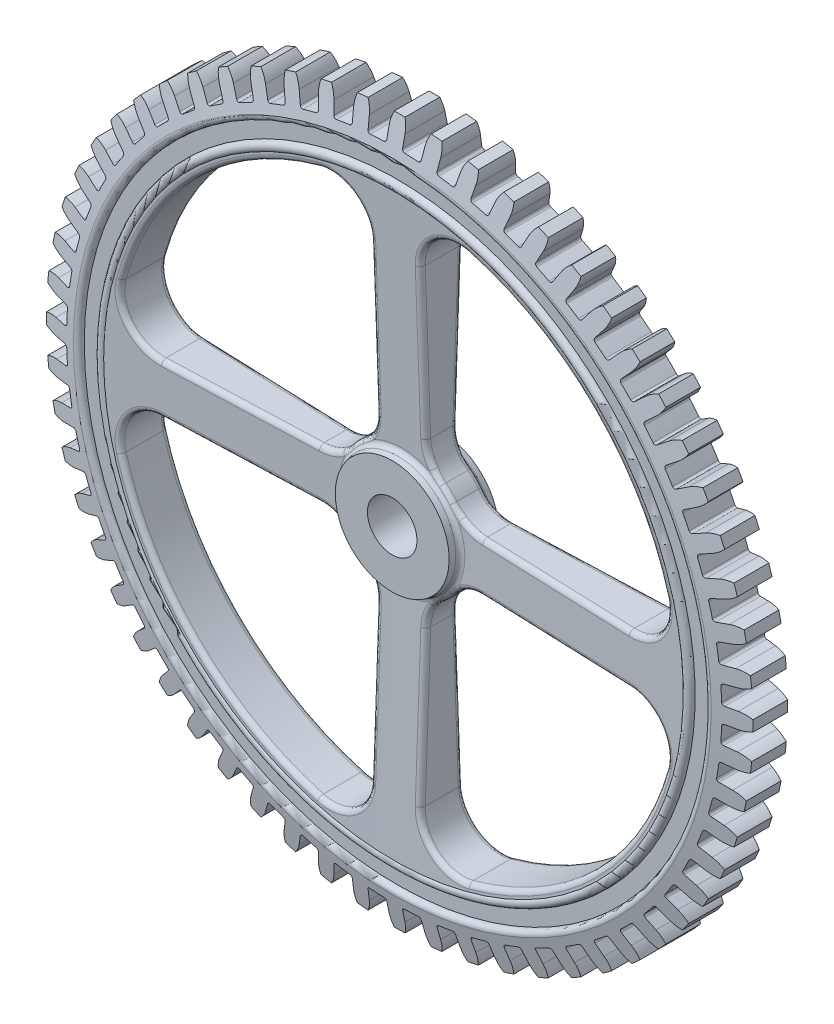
SolidWorks part; units mm, degrees
ref_plane "Спереди" through (0, 0, 0) normal (0, 0, 1) x (1, 0, 0)
ref_plane "Сверху" through (0, 0, 0) normal (0, 1, 0) x (1, 0, 0)
ref_plane "Справа" through (0, 0, 0) normal (1, 0, 0) x (0, 0, -1)
sketch "Эскиз1" plane through (0, 0, 0) normal (0, 1, 0) x (1, 0, 0)
  line L0 (-71.3, 0) -> (0, 0) construction
  line L1 (-71.3, -3.5) -> (-71.3, 3.5)
  line L2 (-5, 5) -> (-5, -5)
  line L3 (-5, 5) -> (-11.485, 5)
  line L4 (-71.3, 3.5) -> (-64.3459, 4.9781)
  line L5 (-63.138, 4) -> (-60.138, 4)
  line L6 (-11.485, 5) -> (-11.7073, 3.8775)
  line L7 (-12.7249, 3.0724) -> (-58.4765, 4.75)
  line L8 (-5, -5) -> (-11.485, -5)
  line L9 (-11.485, -5) -> (-11.7073, -3.8775)
  line L10 (-12.7249, -3.0724) -> (-58.4765, -4.75)
  line L11 (-63.138, -4) -> (-60.138, -4)
  line L12 (-71.3, -3.5) -> (-64.3459, -4.9781)
  line L13 (0, 5) -> (0, -5) construction
  arc A0 (-63.138, 4) -> (-64.3459, 4.9781) centre (-64.138, 4) ccw
  arc A1 (-58.4765, 4.75) -> (-60.138, 4) centre (-59.138, 4) ccw
  arc A2 (-11.7073, 3.8775) -> (-12.7249, 3.0724) centre (-12.6882, 4.0717) cw
  arc A3 (-11.7073, -3.8775) -> (-12.7249, -3.0724) centre (-12.6882, -4.0717) ccw
  arc A4 (-58.4765, -4.75) -> (-60.138, -4) centre (-59.138, -4) cw
  arc A5 (-63.138, -4) -> (-64.3459, -4.9781) centre (-64.138, -4) cw
  point P17 (-5, 0)
  dimension "D7" = 2
  dimension "D13" = 1
  dimension "D1" = 71.3
  dimension "D2" = 5
  dimension "D3" = 5
  dimension "D4" = 6.485
  dimension "D5" = 3.5
  dimension "D6" = 12
  dimension "D8" = 3
  dimension "D9" = 4
  dimension "D10" = 11.2
  dimension "D11" = 2.1
  dimension "D12" = 0.25
revolve "Повернуть1" add sketch "Эскиз1" angle 360 about L13
sketch "Эскиз2" plane through (0, 0, 0) normal (0, 0, 1) x (1, 0, 0)
  line L0 (0, 87.2902) -> (0, 0) construction
  line L1 (0, 0) -> (53, 0) construction
  line L2 (5, 47.244) -> (5, 16.4924)
  line L3 (16.4924, 5) -> (47.244, 5)
  line L4 (47.244, -5) -> (16.4924, -5)
  line L5 (5, -16.4924) -> (5, -47.244)
  line L6 (-5, -47.244) -> (-5, -16.4924)
  line L7 (-16.4924, -5) -> (-47.244, -5)
  line L8 (-47.244, 5) -> (-16.4924, 5)
  line L9 (-5, 16.4924) -> (-5, 47.244)
  arc A0 (10.2096, 8.0476) -> (8.0476, 10.2096) centre (0, 0) ccw
  arc A1 (54.9574, 15.1224) -> (15.1224, 54.9574) centre (0, 0) ccw
  arc A2 (47.244, 5) -> (54.9574, 15.1224) centre (47.244, 13) ccw
  arc A3 (16.4924, 5) -> (10.2096, 8.0476) centre (16.4924, 13) cw
  arc A4 (5, 16.4924) -> (8.0476, 10.2096) centre (13, 16.4924) ccw
  arc A5 (5, 47.244) -> (15.1224, 54.9574) centre (13, 47.244) cw
  arc A6 (8.0476, -10.2096) -> (10.2096, -8.0476) centre (0, 0) ccw
  arc A7 (15.1224, -54.9574) -> (54.9574, -15.1224) centre (0, 0) ccw
  arc A8 (5, -47.244) -> (15.1224, -54.9574) centre (13, -47.244) ccw
  arc A9 (5, -16.4924) -> (8.0476, -10.2096) centre (13, -16.4924) cw
  arc A10 (16.4924, -5) -> (10.2096, -8.0476) centre (16.4924, -13) ccw
  arc A11 (47.244, -5) -> (54.9574, -15.1224) centre (47.244, -13) cw
  arc A12 (-10.2096, -8.0476) -> (-8.0476, -10.2096) centre (0, 0) ccw
  arc A13 (-54.9574, -15.1224) -> (-15.1224, -54.9574) centre (0, 0) ccw
  arc A14 (-47.244, -5) -> (-54.9574, -15.1224) centre (-47.244, -13) ccw
  arc A15 (-16.4924, -5) -> (-10.2096, -8.0476) centre (-16.4924, -13) cw
  arc A16 (-5, -16.4924) -> (-8.0476, -10.2096) centre (-13, -16.4924) ccw
  arc A17 (-5, -47.244) -> (-15.1224, -54.9574) centre (-13, -47.244) cw
  arc A18 (-8.0476, 10.2096) -> (-10.2096, 8.0476) centre (0, 0) ccw
  arc A19 (-15.1224, 54.9574) -> (-54.9574, 15.1224) centre (0, 0) ccw
  arc A20 (-5, 47.244) -> (-15.1224, 54.9574) centre (-13, 47.244) ccw
  arc A21 (-5, 16.4924) -> (-8.0476, 10.2096) centre (-13, 16.4924) cw
  arc A22 (-16.4924, 5) -> (-10.2096, 8.0476) centre (-16.4924, 13) ccw
  arc A23 (-47.244, 5) -> (-54.9574, 15.1224) centre (-47.244, 13) cw
  dimension "D3" = 26
  dimension "D4" = 114
  dimension "D5" = 8
  dimension "D1" = 5
  dimension "D2" = 5
  dimension "D7" = 10
  dimension "D9" = 53
  dimension "D6" = 4
extrude "Вырез-Вытянуть1" cut sketch "Эскиз2" against normal mid plane 10
fillet "Скругление1" radius 1 64 edges at (-12.1999, 6.2492, -3.1084) (-9.1924, 9.1924, -3.0825) (-5.4509, 13.8447, -3.1514) (-7.5875, 53.1351, -4.5739) (-40.3051, 40.3051, -4.6959) (-6.2492, -12.1999, -3.1084) (-9.1924, -9.1924, -3.0825) (-13.8447, -5.4509, -3.1514) (-53.1351, -7.5875, -4.5739) (-40.3051, -40.3051, -4.6959) (-8.7638, -54.0304, -4.6129) (12.1999, -6.2492, -3.1084) (9.1924, -9.1924, -3.0825) (5.4509, -13.8447, -3.1514) (7.5875, -53.1351, -4.5739) (40.3051, -40.3051, -4.6959) (54.0304, -8.7638, -4.6129) (53.1351, 7.5875, -4.5739) (40.3051, 40.3051, -4.6959) (8.7638, 54.0304, -4.6129) (6.2492, 12.1999, -3.1084) (9.1924, 9.1924, -3.0825) (13.8447, 5.4509, -3.1514) (12.1999, 6.2492, 3.1084) (9.1924, 9.1924, 3.0825) (5.4509, 13.8447, 3.1514) (7.5875, 53.1351, 4.5739) (40.3051, 40.3051, 4.6959) (54.0304, 8.7638, 4.6129) (53.1351, -7.5875, 4.5739) (40.3051, -40.3051, 4.6959) (8.7638, -54.0304, 4.6129) (6.2492, -12.1999, 3.1084) (9.1924, -9.1924, 3.0825) (13.8447, -5.4509, 3.1514) (-12.1999, -6.2492, 3.1084) (-9.1924, -9.1924, 3.0825) (-5.4509, -13.8447, 3.1514) (-7.5875, -53.1351, 4.5739) (-40.3051, -40.3051, 4.6959) (-54.0304, -8.7638, 4.6129) (-40.3051, 40.3051, 4.6959) (-8.7638, 54.0304, 4.6129) (-6.2492, 12.1999, 3.1084) (-9.1924, 9.1924, 3.0825) (-13.8447, 5.4509, 3.1514) (-54.0304, 8.7638, -4.6129) (-53.1351, 7.5875, 4.5739)
sketch "Эскиз5" plane through (0, 0, 0) normal (0, 0, 1) x (1, 0, 0)
  line L0 (0, 80.2004) -> (0, -81.6903) construction
  line L1 (0, 0) -> (3.6112, 68.9054) construction
  line L2 (-1.6, 68.8596) -> (-1.6, 66.5669)
  line L3 (1.6, 68.8596) -> (1.6, 66.5669)
  line L4 (5.6065, 68.6496) -> (5.3669, 66.3695)
  line L5 (8.789, 68.3151) -> (8.5494, 66.035)
  line L6 (12.7517, 67.6875) -> (12.275, 65.4449)
  line L7 (15.8817, 67.0222) -> (15.4051, 64.7796)
  line L8 (19.7571, 65.9838) -> (19.0486, 63.8033)
  line L9 (22.8005, 64.9949) -> (22.092, 62.8144)
  line L10 (26.546, 63.5571) -> (25.6135, 61.4627)
  line L11 (29.4694, 62.2556) -> (28.5369, 60.1611)
  line L12 (33.0441, 60.4341) -> (31.8978, 58.4486)
  line L13 (35.8154, 58.8341) -> (34.6691, 56.8486)
  line L14 (39.1802, 56.649) -> (37.8326, 54.7942)
  line L15 (41.7691, 54.7681) -> (40.4215, 52.9133)
  line L16 (44.887, 52.2432) -> (43.3529, 50.5394)
  line L17 (47.2651, 50.102) -> (45.731, 48.3982)
  line L18 (50.102, 47.2651) -> (48.3982, 45.731)
  line L19 (52.2432, 44.887) -> (50.5394, 43.3529)
  line L20 (54.7681, 41.7691) -> (52.9133, 40.4215)
  line L21 (56.649, 39.1802) -> (54.7942, 37.8326)
  line L22 (58.8341, 35.8154) -> (56.8486, 34.6691)
  line L23 (60.4341, 33.0441) -> (58.4486, 31.8978)
  line L24 (62.2556, 29.4694) -> (60.1611, 28.5369)
  line L25 (63.5571, 26.546) -> (61.4627, 25.6135)
  line L26 (64.9949, 22.8005) -> (62.8144, 22.092)
  line L27 (65.9838, 19.7571) -> (63.8033, 19.0486)
  line L28 (67.0222, 15.8817) -> (64.7796, 15.4051)
  line L29 (67.6875, 12.7517) -> (65.4449, 12.275)
  line L30 (68.3151, 8.789) -> (66.035, 8.5494)
  line L31 (68.6496, 5.6065) -> (66.3695, 5.3669)
  line L32 (68.8596, 1.6) -> (66.5669, 1.6)
  line L33 (68.8596, -1.6) -> (66.5669, -1.6)
  line L34 (68.6496, -5.6065) -> (66.3695, -5.3669)
  line L35 (68.3151, -8.789) -> (66.035, -8.5494)
  line L36 (67.6875, -12.7517) -> (65.4449, -12.275)
  line L37 (67.0222, -15.8817) -> (64.7796, -15.4051)
  line L38 (65.9838, -19.7571) -> (63.8033, -19.0486)
  line L39 (64.9949, -22.8005) -> (62.8144, -22.092)
  line L40 (63.5571, -26.546) -> (61.4627, -25.6135)
  line L41 (62.2556, -29.4694) -> (60.1611, -28.5369)
  line L42 (60.4341, -33.0441) -> (58.4486, -31.8978)
  line L43 (58.8341, -35.8154) -> (56.8486, -34.6691)
  line L44 (56.649, -39.1802) -> (54.7942, -37.8326)
  line L45 (54.7681, -41.7691) -> (52.9133, -40.4215)
  line L46 (52.2432, -44.887) -> (50.5394, -43.3529)
  line L47 (50.102, -47.2651) -> (48.3982, -45.731)
  line L48 (47.2651, -50.102) -> (45.731, -48.3982)
  line L49 (44.887, -52.2432) -> (43.3529, -50.5394)
  line L50 (41.7691, -54.7681) -> (40.4215, -52.9133)
  line L51 (39.1802, -56.649) -> (37.8326, -54.7942)
  line L52 (35.8154, -58.8341) -> (34.6691, -56.8486)
  line L53 (33.0441, -60.4341) -> (31.8978, -58.4486)
  line L54 (29.4694, -62.2556) -> (28.3391, -59.7169)
  line L55 (26.546, -63.5571) -> (25.6135, -61.4627)
  line L56 (22.8005, -64.9949) -> (22.092, -62.8144)
  line L57 (19.7571, -65.9838) -> (19.0486, -63.8033)
  line L58 (15.8817, -67.0222) -> (15.4051, -64.7796)
  line L59 (12.7517, -67.6875) -> (12.275, -65.4449)
  line L60 (8.789, -68.3151) -> (8.5494, -66.035)
  line L61 (5.6065, -68.6496) -> (5.3669, -66.3695)
  line L62 (1.6, -68.8596) -> (1.6, -66.5669)
  line L63 (-1.6, -68.8596) -> (-1.6, -66.5669)
  line L64 (-5.6065, -68.6496) -> (-5.3161, -65.8859)
  line L65 (-8.789, -68.3151) -> (-8.5494, -66.035)
  line L66 (-12.7517, -67.6875) -> (-12.275, -65.4449)
  line L67 (-15.8817, -67.0222) -> (-15.4051, -64.7796)
  line L68 (-19.7571, -65.9838) -> (-19.0486, -63.8033)
  line L69 (-22.8005, -64.9949) -> (-22.092, -62.8144)
  line L70 (-26.546, -63.5571) -> (-25.6135, -61.4627)
  line L71 (-29.4694, -62.2556) -> (-28.5369, -60.1611)
  line L72 (-33.0441, -60.4341) -> (-31.8978, -58.4486)
  line L73 (-35.8154, -58.8341) -> (-34.6691, -56.8486)
  line L74 (-39.1802, -56.649) -> (-37.8326, -54.7942)
  line L75 (-41.7691, -54.7681) -> (-40.4215, -52.9133)
  line L76 (-44.887, -52.2432) -> (-43.3529, -50.5394)
  line L77 (-47.2651, -50.102) -> (-45.731, -48.3982)
  line L78 (-50.102, -47.2651) -> (-48.3982, -45.731)
  line L79 (-52.2432, -44.887) -> (-50.5394, -43.3529)
  line L80 (-54.7681, -41.7691) -> (-52.9133, -40.4215)
  line L81 (-56.649, -39.1802) -> (-54.7942, -37.8326)
  line L82 (-58.8341, -35.8154) -> (-56.8486, -34.6691)
  line L83 (-60.4341, -33.0441) -> (-58.4486, -31.8978)
  line L84 (-62.2556, -29.4694) -> (-60.1611, -28.5369)
  line L85 (-63.5571, -26.546) -> (-61.4627, -25.6135)
  line L86 (-64.9949, -22.8005) -> (-62.8144, -22.092)
  line L87 (-65.9838, -19.7571) -> (-63.8033, -19.0486)
  line L88 (-67.0222, -15.8817) -> (-64.7796, -15.4051)
  line L89 (-67.6875, -12.7517) -> (-65.4449, -12.275)
  line L90 (-68.3151, -8.789) -> (-66.035, -8.5494)
  line L91 (-68.6496, -5.6065) -> (-66.3695, -5.3669)
  line L92 (-68.8596, -1.6) -> (-66.5669, -1.6)
  line L93 (-68.8596, 1.6) -> (-66.5669, 1.6)
  line L94 (-68.6496, 5.6065) -> (-66.3695, 5.3669)
  line L95 (-68.3151, 8.789) -> (-66.035, 8.5494)
  line L96 (-67.6875, 12.7517) -> (-65.4449, 12.275)
  line L97 (-67.0222, 15.8817) -> (-64.7796, 15.4051)
  line L98 (-65.9838, 19.7571) -> (-63.8033, 19.0486)
  line L99 (-64.9949, 22.8005) -> (-62.8144, 22.092)
  line L100 (-63.5571, 26.546) -> (-61.4627, 25.6135)
  line L101 (-62.2556, 29.4694) -> (-60.1611, 28.5369)
  line L102 (-60.4341, 33.0441) -> (-58.4486, 31.8978)
  line L103 (-58.8341, 35.8154) -> (-56.8486, 34.6691)
  line L104 (-56.649, 39.1802) -> (-54.7942, 37.8326)
  line L105 (-54.7681, 41.7691) -> (-52.9133, 40.4215)
  line L106 (-52.2432, 44.887) -> (-50.5394, 43.3529)
  line L107 (-50.102, 47.2651) -> (-48.3982, 45.731)
  line L108 (-47.2651, 50.102) -> (-45.731, 48.3982)
  line L109 (-44.887, 52.2432) -> (-43.3529, 50.5394)
  line L110 (-41.7691, 54.7681) -> (-40.4215, 52.9133)
  line L111 (-39.1802, 56.649) -> (-37.8326, 54.7942)
  line L112 (-35.8154, 58.8341) -> (-34.6691, 56.8486)
  line L113 (-33.0441, 60.4341) -> (-31.8978, 58.4486)
  line L114 (-29.4694, 62.2556) -> (-28.5369, 60.1611)
  line L115 (-26.546, 63.5571) -> (-25.6135, 61.4627)
  line L116 (-22.8005, 64.9949) -> (-22.092, 62.8144)
  line L117 (-19.7571, 65.9838) -> (-19.0486, 63.8033)
  line L118 (-15.8817, 67.0222) -> (-15.4051, 64.7796)
  line L119 (-12.7517, 67.6875) -> (-12.275, 65.4449)
  line L120 (-8.789, 68.3151) -> (-8.5494, 66.035)
  line L121 (-5.6065, 68.6496) -> (-5.3669, 66.3695)
  arc A0 (-2.0842, 66.0671) -> (-4.8331, 65.9231) centre (0, 0) ccw
  circle A1 centre (0, 0) radius 71.3 construction
  arc A2 (-1.0849, 71.2917) -> (-1.6, 68.8596) centre (4.4, 68.8596) ccw
  circle A3 centre (0, 0) radius 69 construction
  arc A4 (1.0849, 71.2917) -> (1.6, 68.8596) centre (-4.4, 68.8596) cw
  arc A5 (1.0849, 71.2917) -> (-1.0849, 71.2917) centre (0, 0) ccw
  arc A6 (6.373, 71.0146) -> (5.6065, 68.6496) centre (11.5737, 68.0224) ccw
  arc A7 (8.531, 70.7878) -> (8.789, 68.3151) centre (2.8219, 68.9423) cw
  arc A8 (8.531, 70.7878) -> (6.373, 71.0146) centre (0, 0) ccw
  arc A9 (13.7612, 69.9594) -> (12.7517, 67.6875) centre (18.6206, 66.44) ccw
  arc A10 (15.8836, 69.5083) -> (15.8817, 67.0222) centre (10.0129, 68.2696) cw
  arc A11 (15.8836, 69.5083) -> (13.7612, 69.9594) centre (0, 0) ccw
  arc A12 (20.9985, 68.1377) -> (19.7571, 65.9838) centre (25.4634, 64.1297) ccw
  arc A13 (23.0622, 67.4672) -> (22.8005, 64.9949) centre (17.0941, 66.849) cw
  arc A14 (23.0622, 67.4672) -> (20.9985, 68.1377) centre (0, 0) ccw
  arc A15 (28.0058, 65.5695) -> (26.546, 63.5571) centre (32.0273, 61.1167) ccw
  arc A16 (29.9881, 64.687) -> (29.4694, 62.2556) centre (23.9881, 64.696) cw
  arc A17 (29.9881, 64.687) -> (28.0058, 65.5695) centre (0, 0) ccw
  arc A18 (34.7063, 62.2829) -> (33.0441, 60.4341) centre (38.2403, 57.4341) ccw
  arc A19 (36.5855, 61.198) -> (35.8154, 58.8341) centre (30.6193, 61.8341) cw
  arc A20 (36.5855, 61.198) -> (34.7063, 62.2829) centre (0, 0) ccw
  arc A21 (41.0265, 58.3139) -> (39.1802, 56.649) centre (44.0343, 53.1223) ccw
  arc A22 (42.782, 57.0385) -> (41.7691, 54.7681) centre (36.915, 58.2948) cw
  arc A23 (42.782, 57.0385) -> (41.0265, 58.3139) centre (0, 0) ccw
  arc A24 (46.8972, 53.7061) -> (44.887, 52.2432) centre (49.3459, 48.2285) ccw
  arc A25 (48.5098, 52.2541) -> (47.2651, 50.102) centre (42.8062, 54.1168) cw
  arc A26 (48.5098, 52.2541) -> (46.8972, 53.7061) centre (0, 0) ccw
  arc A27 (52.2541, 48.5098) -> (50.102, 47.2651) centre (54.1168, 42.8062) ccw
  arc A28 (53.7061, 46.8972) -> (52.2432, 44.887) centre (48.2285, 49.3459) cw
  arc A29 (53.7061, 46.8972) -> (52.2541, 48.5098) centre (0, 0) ccw
  arc A30 (57.0385, 42.782) -> (54.7681, 41.7691) centre (58.2948, 36.915) ccw
  arc A31 (58.3139, 41.0265) -> (56.649, 39.1802) centre (53.1223, 44.0343) cw
  arc A32 (58.3139, 41.0265) -> (57.0385, 42.782) centre (0, 0) ccw
  arc A33 (61.198, 36.5855) -> (58.8341, 35.8154) centre (61.8341, 30.6193) ccw
  arc A34 (62.2829, 34.7063) -> (60.4341, 33.0441) centre (57.4341, 38.2403) cw
  arc A35 (62.2829, 34.7063) -> (61.198, 36.5855) centre (0, 0) ccw
  arc A36 (64.687, 29.9881) -> (62.2556, 29.4694) centre (64.696, 23.9881) ccw
  arc A37 (65.5695, 28.0058) -> (63.5571, 26.546) centre (61.1167, 32.0273) cw
  arc A38 (65.5695, 28.0058) -> (64.687, 29.9881) centre (0, 0) ccw
  arc A39 (67.4672, 23.0622) -> (64.9949, 22.8005) centre (66.849, 17.0941) ccw
  arc A40 (68.1377, 20.9985) -> (65.9838, 19.7571) centre (64.1297, 25.4634) cw
  arc A41 (68.1377, 20.9985) -> (67.4672, 23.0622) centre (0, 0) ccw
  arc A42 (69.5083, 15.8836) -> (67.0222, 15.8817) centre (68.2696, 10.0129) ccw
  arc A43 (69.9594, 13.7612) -> (67.6875, 12.7517) centre (66.44, 18.6206) cw
  arc A44 (69.9594, 13.7612) -> (69.5083, 15.8836) centre (0, 0) ccw
  arc A45 (70.7878, 8.531) -> (68.3151, 8.789) centre (68.9423, 2.8219) ccw
  arc A46 (71.0146, 6.373) -> (68.6496, 5.6065) centre (68.0224, 11.5737) cw
  arc A47 (71.0146, 6.373) -> (70.7878, 8.531) centre (0, 0) ccw
  arc A48 (71.2917, 1.0849) -> (68.8596, 1.6) centre (68.8596, -4.4) ccw
  arc A49 (71.2917, -1.0849) -> (68.8596, -1.6) centre (68.8596, 4.4) cw
  arc A50 (71.2917, -1.0849) -> (71.2917, 1.0849) centre (0, 0) ccw
  arc A51 (71.0146, -6.373) -> (68.6496, -5.6065) centre (68.0224, -11.5737) ccw
  arc A52 (70.7878, -8.531) -> (68.3151, -8.789) centre (68.9423, -2.8219) cw
  arc A53 (70.7878, -8.531) -> (71.0146, -6.373) centre (0, 0) ccw
  arc A54 (69.9594, -13.7612) -> (67.6875, -12.7517) centre (66.44, -18.6206) ccw
  arc A55 (69.5083, -15.8836) -> (67.0222, -15.8817) centre (68.2696, -10.0129) cw
  arc A56 (69.5083, -15.8836) -> (69.9594, -13.7612) centre (0, 0) ccw
  arc A57 (68.1377, -20.9985) -> (65.9838, -19.7571) centre (64.1297, -25.4634) ccw
  arc A58 (67.4672, -23.0622) -> (64.9949, -22.8005) centre (66.849, -17.0941) cw
  arc A59 (67.4672, -23.0622) -> (68.1377, -20.9985) centre (0, 0) ccw
  arc A60 (65.5695, -28.0058) -> (63.5571, -26.546) centre (61.1167, -32.0273) ccw
  arc A61 (64.687, -29.9881) -> (62.2556, -29.4694) centre (64.696, -23.9881) cw
  arc A62 (64.687, -29.9881) -> (65.5695, -28.0058) centre (0, 0) ccw
  arc A63 (62.2829, -34.7063) -> (60.4341, -33.0441) centre (57.4341, -38.2403) ccw
  arc A64 (61.198, -36.5855) -> (58.8341, -35.8154) centre (61.8341, -30.6193) cw
  arc A65 (61.198, -36.5855) -> (62.2829, -34.7063) centre (0, 0) ccw
  arc A66 (58.3139, -41.0265) -> (56.649, -39.1802) centre (53.1223, -44.0343) ccw
  arc A67 (57.0385, -42.782) -> (54.7681, -41.7691) centre (58.2948, -36.915) cw
  arc A68 (57.0385, -42.782) -> (58.3139, -41.0265) centre (0, 0) ccw
  arc A69 (53.7061, -46.8972) -> (52.2432, -44.887) centre (48.2285, -49.3459) ccw
  arc A70 (52.2541, -48.5098) -> (50.102, -47.2651) centre (54.1168, -42.8062) cw
  arc A71 (52.2541, -48.5098) -> (53.7061, -46.8972) centre (0, 0) ccw
  arc A72 (48.5098, -52.2541) -> (47.2651, -50.102) centre (42.8062, -54.1168) ccw
  arc A73 (46.8972, -53.7061) -> (44.887, -52.2432) centre (49.3459, -48.2285) cw
  arc A74 (46.8972, -53.7061) -> (48.5098, -52.2541) centre (0, 0) ccw
  arc A75 (42.782, -57.0385) -> (41.7691, -54.7681) centre (36.915, -58.2948) ccw
  arc A76 (41.0265, -58.3139) -> (39.1802, -56.649) centre (44.0343, -53.1223) cw
  arc A77 (41.0265, -58.3139) -> (42.782, -57.0385) centre (0, 0) ccw
  arc A78 (36.5855, -61.198) -> (35.8154, -58.8341) centre (30.6193, -61.8341) ccw
  arc A79 (34.7063, -62.2829) -> (33.0441, -60.4341) centre (38.2403, -57.4341) cw
  arc A80 (34.7063, -62.2829) -> (36.5855, -61.198) centre (0, 0) ccw
  arc A81 (29.9881, -64.687) -> (29.4694, -62.2556) centre (23.9881, -64.696) ccw
  arc A82 (28.0058, -65.5695) -> (26.546, -63.5571) centre (32.0273, -61.1167) cw
  arc A83 (28.0058, -65.5695) -> (29.9881, -64.687) centre (0, 0) ccw
  arc A84 (23.0622, -67.4672) -> (22.8005, -64.9949) centre (17.0941, -66.849) ccw
  arc A85 (20.9985, -68.1377) -> (19.7571, -65.9838) centre (25.4634, -64.1297) cw
  arc A86 (20.9985, -68.1377) -> (23.0622, -67.4672) centre (0, 0) ccw
  arc A87 (15.8836, -69.5083) -> (15.8817, -67.0222) centre (10.0129, -68.2696) ccw
  arc A88 (13.7612, -69.9594) -> (12.7517, -67.6875) centre (18.6206, -66.44) cw
  arc A89 (13.7612, -69.9594) -> (15.8836, -69.5083) centre (0, 0) ccw
  arc A90 (8.531, -70.7878) -> (8.789, -68.3151) centre (2.8219, -68.9423) ccw
  arc A91 (6.373, -71.0146) -> (5.6065, -68.6496) centre (11.5737, -68.0224) cw
  arc A92 (6.373, -71.0146) -> (8.531, -70.7878) centre (0, 0) ccw
  arc A93 (1.0849, -71.2917) -> (1.6, -68.8596) centre (-4.4, -68.8596) ccw
  arc A94 (-1.0849, -71.2917) -> (-1.6, -68.8596) centre (4.4, -68.8596) cw
  arc A95 (-1.0849, -71.2917) -> (1.0849, -71.2917) centre (0, 0) ccw
  arc A96 (-6.373, -71.0146) -> (-5.6065, -68.6496) centre (-11.5737, -68.0224) ccw
  arc A97 (-8.531, -70.7878) -> (-8.789, -68.3151) centre (-2.8219, -68.9423) cw
  arc A98 (-8.531, -70.7878) -> (-6.373, -71.0146) centre (0, 0) ccw
  arc A99 (-13.7612, -69.9594) -> (-12.7517, -67.6875) centre (-18.6206, -66.44) ccw
  arc A100 (-15.8836, -69.5083) -> (-15.8817, -67.0222) centre (-10.0129, -68.2696) cw
  arc A101 (-15.8836, -69.5083) -> (-13.7612, -69.9594) centre (0, 0) ccw
  arc A102 (-20.9985, -68.1377) -> (-19.7571, -65.9838) centre (-25.4634, -64.1297) ccw
  arc A103 (-23.0622, -67.4672) -> (-22.8005, -64.9949) centre (-17.0941, -66.849) cw
  arc A104 (-23.0622, -67.4672) -> (-20.9985, -68.1377) centre (0, 0) ccw
  arc A105 (-28.0058, -65.5695) -> (-26.546, -63.5571) centre (-32.0273, -61.1167) ccw
  arc A106 (-29.9881, -64.687) -> (-29.4694, -62.2556) centre (-23.9881, -64.696) cw
  arc A107 (-29.9881, -64.687) -> (-28.0058, -65.5695) centre (0, 0) ccw
  arc A108 (-34.7063, -62.2829) -> (-33.0441, -60.4341) centre (-38.2403, -57.4341) ccw
  arc A109 (-36.5855, -61.198) -> (-35.8154, -58.8341) centre (-30.6193, -61.8341) cw
  arc A110 (-36.5855, -61.198) -> (-34.7063, -62.2829) centre (0, 0) ccw
  arc A111 (-41.0265, -58.3139) -> (-39.1802, -56.649) centre (-44.0343, -53.1223) ccw
  arc A112 (-42.782, -57.0385) -> (-41.7691, -54.7681) centre (-36.915, -58.2948) cw
  arc A113 (-42.782, -57.0385) -> (-41.0265, -58.3139) centre (0, 0) ccw
  arc A114 (-46.8972, -53.7061) -> (-44.887, -52.2432) centre (-49.3459, -48.2285) ccw
  arc A115 (-48.5098, -52.2541) -> (-47.2651, -50.102) centre (-42.8062, -54.1168) cw
  arc A116 (-48.5098, -52.2541) -> (-46.8972, -53.7061) centre (0, 0) ccw
  arc A117 (-52.2541, -48.5098) -> (-50.102, -47.2651) centre (-54.1168, -42.8062) ccw
  arc A118 (-53.7061, -46.8972) -> (-52.2432, -44.887) centre (-48.2285, -49.3459) cw
  arc A119 (-53.7061, -46.8972) -> (-52.2541, -48.5098) centre (0, 0) ccw
  arc A120 (-57.0385, -42.782) -> (-54.7681, -41.7691) centre (-58.2948, -36.915) ccw
  arc A121 (-58.3139, -41.0265) -> (-56.649, -39.1802) centre (-53.1223, -44.0343) cw
  arc A122 (-58.3139, -41.0265) -> (-57.0385, -42.782) centre (0, 0) ccw
  arc A123 (-61.198, -36.5855) -> (-58.8341, -35.8154) centre (-61.8341, -30.6193) ccw
  arc A124 (-62.2829, -34.7063) -> (-60.4341, -33.0441) centre (-57.4341, -38.2403) cw
  arc A125 (-62.2829, -34.7063) -> (-61.198, -36.5855) centre (0, 0) ccw
  arc A126 (-64.687, -29.9881) -> (-62.2556, -29.4694) centre (-64.696, -23.9881) ccw
  arc A127 (-65.5695, -28.0058) -> (-63.5571, -26.546) centre (-61.1167, -32.0273) cw
  arc A128 (-65.5695, -28.0058) -> (-64.687, -29.9881) centre (0, 0) ccw
  arc A129 (-67.4672, -23.0622) -> (-64.9949, -22.8005) centre (-66.849, -17.0941) ccw
  arc A130 (-68.1377, -20.9985) -> (-65.9838, -19.7571) centre (-64.1297, -25.4634) cw
  arc A131 (-68.1377, -20.9985) -> (-67.4672, -23.0622) centre (0, 0) ccw
  arc A132 (-69.5083, -15.8836) -> (-67.0222, -15.8817) centre (-68.2696, -10.0129) ccw
  arc A133 (-69.9594, -13.7612) -> (-67.6875, -12.7517) centre (-66.44, -18.6206) cw
  arc A134 (-69.9594, -13.7612) -> (-69.5083, -15.8836) centre (0, 0) ccw
  arc A135 (-70.7878, -8.531) -> (-68.3151, -8.789) centre (-68.9423, -2.8219) ccw
  arc A136 (-71.0146, -6.373) -> (-68.6496, -5.6065) centre (-68.0224, -11.5737) cw
  arc A137 (-71.0146, -6.373) -> (-70.7878, -8.531) centre (0, 0) ccw
  arc A138 (-71.2917, -1.0849) -> (-68.8596, -1.6) centre (-68.8596, 4.4) ccw
  arc A139 (-71.2917, 1.0849) -> (-68.8596, 1.6) centre (-68.8596, -4.4) cw
  arc A140 (-71.2917, 1.0849) -> (-71.2917, -1.0849) centre (0, 0) ccw
  arc A141 (-71.0146, 6.373) -> (-68.6496, 5.6065) centre (-68.0224, 11.5737) ccw
  arc A142 (-70.7878, 8.531) -> (-68.3151, 8.789) centre (-68.9423, 2.8219) cw
  arc A143 (-70.7878, 8.531) -> (-71.0146, 6.373) centre (0, 0) ccw
  arc A144 (-69.9594, 13.7612) -> (-67.6875, 12.7517) centre (-66.44, 18.6206) ccw
  arc A145 (-69.5083, 15.8836) -> (-67.0222, 15.8817) centre (-68.2696, 10.0129) cw
  arc A146 (-69.5083, 15.8836) -> (-69.9594, 13.7612) centre (0, 0) ccw
  arc A147 (-68.1377, 20.9985) -> (-65.9838, 19.7571) centre (-64.1297, 25.4634) ccw
  arc A148 (-67.4672, 23.0622) -> (-64.9949, 22.8005) centre (-66.849, 17.0941) cw
  arc A149 (-67.4672, 23.0622) -> (-68.1377, 20.9985) centre (0, 0) ccw
  arc A150 (-65.5695, 28.0058) -> (-63.5571, 26.546) centre (-61.1167, 32.0273) ccw
  arc A151 (-64.687, 29.9881) -> (-62.2556, 29.4694) centre (-64.696, 23.9881) cw
  arc A152 (-64.687, 29.9881) -> (-65.5695, 28.0058) centre (0, 0) ccw
  arc A153 (-62.2829, 34.7063) -> (-60.4341, 33.0441) centre (-57.4341, 38.2403) ccw
  arc A154 (-61.198, 36.5855) -> (-58.8341, 35.8154) centre (-61.8341, 30.6193) cw
  arc A155 (-61.198, 36.5855) -> (-62.2829, 34.7063) centre (0, 0) ccw
  arc A156 (-58.3139, 41.0265) -> (-56.649, 39.1802) centre (-53.1223, 44.0343) ccw
  arc A157 (-57.0385, 42.782) -> (-54.7681, 41.7691) centre (-58.2948, 36.915) cw
  arc A158 (-57.0385, 42.782) -> (-58.3139, 41.0265) centre (0, 0) ccw
  arc A159 (-53.7061, 46.8972) -> (-52.2432, 44.887) centre (-48.2285, 49.3459) ccw
  arc A160 (-52.2541, 48.5098) -> (-50.102, 47.2651) centre (-54.1168, 42.8062) cw
  arc A161 (-52.2541, 48.5098) -> (-53.7061, 46.8972) centre (0, 0) ccw
  arc A162 (-48.5098, 52.2541) -> (-47.2651, 50.102) centre (-42.8062, 54.1168) ccw
  arc A163 (-46.8972, 53.7061) -> (-44.887, 52.2432) centre (-49.3459, 48.2285) cw
  arc A164 (-46.8972, 53.7061) -> (-48.5098, 52.2541) centre (0, 0) ccw
  arc A165 (-42.782, 57.0385) -> (-41.7691, 54.7681) centre (-36.915, 58.2948) ccw
  arc A166 (-41.0265, 58.3139) -> (-39.1802, 56.649) centre (-44.0343, 53.1223) cw
  arc A167 (-41.0265, 58.3139) -> (-42.782, 57.0385) centre (0, 0) ccw
  arc A168 (-36.5855, 61.198) -> (-35.8154, 58.8341) centre (-30.6193, 61.8341) ccw
  arc A169 (-34.7063, 62.2829) -> (-33.0441, 60.4341) centre (-38.2403, 57.4341) cw
  arc A170 (-34.7063, 62.2829) -> (-36.5855, 61.198) centre (0, 0) ccw
  arc A171 (-29.9881, 64.687) -> (-29.4694, 62.2556) centre (-23.9881, 64.696) ccw
  arc A172 (-28.0058, 65.5695) -> (-26.546, 63.5571) centre (-32.0273, 61.1167) cw
  arc A173 (-28.0058, 65.5695) -> (-29.9881, 64.687) centre (0, 0) ccw
  arc A174 (-23.0622, 67.4672) -> (-22.8005, 64.9949) centre (-17.0941, 66.849) ccw
  arc A175 (-20.9985, 68.1377) -> (-19.7571, 65.9838) centre (-25.4634, 64.1297) cw
  arc A176 (-20.9985, 68.1377) -> (-23.0622, 67.4672) centre (0, 0) ccw
  arc A177 (-15.8836, 69.5083) -> (-15.8817, 67.0222) centre (-10.0129, 68.2696) ccw
  arc A178 (-13.7612, 69.9594) -> (-12.7517, 67.6875) centre (-18.6206, 66.44) cw
  arc A179 (-13.7612, 69.9594) -> (-15.8836, 69.5083) centre (0, 0) ccw
  arc A180 (-8.531, 70.7878) -> (-8.789, 68.3151) centre (-2.8219, 68.9423) ccw
  arc A181 (-6.373, 71.0146) -> (-5.6065, 68.6496) centre (-11.5737, 68.0224) cw
  arc A182 (-6.373, 71.0146) -> (-8.531, 70.7878) centre (0, 0) ccw
  arc A183 (-22.3981, 62.1895) -> (-24.9679, 61.2031) centre (0, 0) ccw
  arc A184 (-28.776, 59.5076) -> (-31.2286, 58.2579) centre (0, 0) ccw
  arc A185 (-15.7748, 64.1901) -> (-18.4336, 63.4776) centre (0, 0) ccw
  arc A186 (-8.9787, 65.4873) -> (-11.6974, 65.0567) centre (0, 0) ccw
  arc A187 (4.8331, 65.9231) -> (2.0842, 66.0671) centre (0, 0) ccw
  arc A188 (11.6974, 65.0567) -> (8.9787, 65.4873) centre (0, 0) ccw
  arc A189 (18.4336, 63.4776) -> (15.7748, 64.1901) centre (0, 0) ccw
  arc A190 (-34.8386, 56.1737) -> (-37.1471, 54.6745) centre (0, 0) ccw
  arc A191 (-40.5195, 52.2244) -> (-42.6587, 50.4921) centre (0, 0) ccw
  arc A192 (24.9679, 61.2031) -> (22.3981, 62.1895) centre (0, 0) ccw
  arc A193 (31.2286, 58.2579) -> (28.776, 59.5076) centre (0, 0) ccw
  arc A194 (37.1471, 54.6745) -> (34.8386, 56.1737) centre (0, 0) ccw
  arc A195 (42.6587, 50.4921) -> (40.5195, 52.2244) centre (0, 0) ccw
  arc A196 (47.7028, 45.7564) -> (45.7564, 47.7028) centre (0, 0) ccw
  arc A197 (52.2244, 40.5195) -> (50.4921, 42.6587) centre (0, 0) ccw
  arc A198 (56.1737, 34.8386) -> (54.6745, 37.1471) centre (0, 0) ccw
  arc A199 (59.5076, 28.776) -> (58.2579, 31.2286) centre (0, 0) ccw
  arc A200 (62.1895, 22.3981) -> (61.2031, 24.9679) centre (0, 0) ccw
  arc A201 (64.1901, 15.7748) -> (63.4776, 18.4336) centre (0, 0) ccw
  arc A202 (65.4873, 8.9787) -> (65.0567, 11.6974) centre (0, 0) ccw
  arc A203 (66.0671, 2.0842) -> (65.9231, 4.8331) centre (0, 0) ccw
  arc A204 (65.9231, -4.8331) -> (66.0671, -2.0842) centre (0, 0) ccw
  arc A205 (65.0567, -11.6974) -> (65.4873, -8.9787) centre (0, 0) ccw
  arc A206 (63.4776, -18.4336) -> (64.1901, -15.7748) centre (0, 0) ccw
  arc A207 (58.2579, -31.2286) -> (59.5076, -28.776) centre (0, 0) ccw
  arc A208 (61.2031, -24.9679) -> (62.1895, -22.3981) centre (0, 0) ccw
  arc A209 (54.6745, -37.1471) -> (56.1737, -34.8386) centre (0, 0) ccw
  arc A210 (2.0842, -66.0671) -> (4.8331, -65.9231) centre (0, 0) ccw
  arc A211 (8.9787, -65.4873) -> (11.6974, -65.0567) centre (0, 0) ccw
  arc A212 (15.7748, -64.1901) -> (18.4336, -63.4776) centre (0, 0) ccw
  arc A213 (22.3981, -62.1895) -> (24.9679, -61.2031) centre (0, 0) ccw
  arc A214 (28.3391, -59.7169) -> (31.2286, -58.2579) centre (0, 0) ccw
  arc A215 (34.8386, -56.1737) -> (37.1471, -54.6745) centre (0, 0) ccw
  arc A216 (40.5195, -52.2244) -> (42.6587, -50.4921) centre (0, 0) ccw
  arc A217 (45.7564, -47.7028) -> (47.7028, -45.7564) centre (0, 0) ccw
  arc A218 (50.4921, -42.6587) -> (52.2244, -40.5195) centre (0, 0) ccw
  arc A219 (-5.3161, -65.8859) -> (-2.0842, -66.0671) centre (0, 0) ccw
  arc A220 (-11.6974, -65.0567) -> (-8.9787, -65.4873) centre (0, 0) ccw
  arc A221 (-18.4336, -63.4776) -> (-15.7748, -64.1901) centre (0, 0) ccw
  arc A222 (-24.9679, -61.2031) -> (-22.3981, -62.1895) centre (0, 0) ccw
  arc A223 (-31.2286, -58.2579) -> (-28.776, -59.5076) centre (0, 0) ccw
  arc A224 (-37.1471, -54.6745) -> (-34.8386, -56.1737) centre (0, 0) ccw
  arc A225 (-42.6587, -50.4921) -> (-40.5195, -52.2244) centre (0, 0) ccw
  arc A226 (-47.7028, -45.7564) -> (-45.7564, -47.7028) centre (0, 0) ccw
  arc A227 (-52.2244, -40.5195) -> (-50.4921, -42.6587) centre (0, 0) ccw
  arc A228 (-56.1737, -34.8386) -> (-54.6745, -37.1471) centre (0, 0) ccw
  arc A229 (-59.5076, -28.776) -> (-58.2579, -31.2286) centre (0, 0) ccw
  arc A230 (-62.1895, -22.3981) -> (-61.2031, -24.9679) centre (0, 0) ccw
  arc A231 (-64.1901, -15.7748) -> (-63.4776, -18.4336) centre (0, 0) ccw
  arc A232 (-65.4873, -8.9787) -> (-65.0567, -11.6974) centre (0, 0) ccw
  arc A233 (-66.0671, -2.0842) -> (-65.9231, -4.8331) centre (0, 0) ccw
  arc A234 (-65.9231, 4.8331) -> (-66.0671, 2.0842) centre (0, 0) ccw
  arc A235 (-65.0567, 11.6974) -> (-65.4873, 8.9787) centre (0, 0) ccw
  arc A236 (-63.4776, 18.4336) -> (-64.1901, 15.7748) centre (0, 0) ccw
  arc A237 (-61.2031, 24.9679) -> (-62.1895, 22.3981) centre (0, 0) ccw
  arc A238 (-58.2579, 31.2286) -> (-59.5076, 28.776) centre (0, 0) ccw
  arc A239 (-54.6745, 37.1471) -> (-56.1737, 34.8386) centre (0, 0) ccw
  arc A240 (-50.4921, 42.6587) -> (-52.2244, 40.5195) centre (0, 0) ccw
  arc A241 (-45.7564, 47.7028) -> (-47.7028, 45.7564) centre (0, 0) ccw
  arc A242 (-22.092, 62.8144) -> (-22.3981, 62.1895) centre (-22.5675, 62.6599) cw
  arc A243 (-25.6135, 61.4627) -> (-24.9679, 61.2031) centre (-25.1567, 61.666) ccw
  arc A244 (-28.5369, 60.1611) -> (-28.776, 59.5076) centre (-28.9936, 59.9577) cw
  arc A245 (-31.8978, 58.4486) -> (-31.2286, 58.2579) centre (-31.4648, 58.6986) ccw
  arc A246 (-34.6691, 56.8486) -> (-34.8386, 56.1737) centre (-35.1021, 56.5986) cw
  arc A247 (-37.8326, 54.7942) -> (-37.1471, 54.6745) centre (-37.4281, 55.0881) ccw
  arc A248 (-40.4215, 52.9133) -> (-40.5195, 52.2244) centre (-40.826, 52.6194) cw
  arc A249 (-43.3529, 50.5394) -> (-42.6587, 50.4921) centre (-42.9813, 50.874) ccw
  arc A250 (-45.731, 48.3982) -> (-45.7564, 47.7028) centre (-46.1025, 48.0637) cw
  arc A251 (-48.3982, 45.731) -> (-47.7028, 45.7564) centre (-48.0637, 46.1025) ccw
  arc A252 (-50.5394, 43.3529) -> (-50.4921, 42.6587) centre (-50.874, 42.9813) cw
  arc A253 (-52.9133, 40.4215) -> (-52.2244, 40.5195) centre (-52.6194, 40.826) ccw
  arc A254 (-54.7942, 37.8326) -> (-54.6745, 37.1471) centre (-55.0881, 37.4281) cw
  arc A255 (-56.8486, 34.6691) -> (-56.1737, 34.8386) centre (-56.5986, 35.1021) ccw
  arc A256 (-58.4486, 31.8978) -> (-58.2579, 31.2286) centre (-58.6986, 31.4648) cw
  arc A257 (-60.1611, 28.5369) -> (-59.5076, 28.776) centre (-59.9577, 28.9936) ccw
  arc A258 (-61.4627, 25.6135) -> (-61.2031, 24.9679) centre (-61.666, 25.1567) cw
  arc A259 (-62.8144, 22.092) -> (-62.1895, 22.3981) centre (-62.6599, 22.5675) ccw
  arc A260 (-63.8033, 19.0486) -> (-63.4776, 18.4336) centre (-63.9578, 18.5731) cw
  arc A261 (-64.7796, 15.4051) -> (-64.1901, 15.7748) centre (-64.6756, 15.8941) ccw
  arc A262 (-65.4449, 12.275) -> (-65.0567, 11.6974) centre (-65.5489, 11.7859) cw
  arc A263 (-66.035, 8.5494) -> (-65.4873, 8.9787) centre (-65.9827, 9.0466) ccw
  arc A264 (-66.3695, 5.3669) -> (-65.9231, 4.8331) centre (-66.4217, 4.8696) cw
  arc A265 (-66.5669, 1.6) -> (-66.0671, 2.0842) centre (-66.5669, 2.1) ccw
  arc A266 (-66.5669, -1.6) -> (-66.0671, -2.0842) centre (-66.5669, -2.1) cw
  arc A267 (-66.3695, -5.3669) -> (-65.9231, -4.8331) centre (-66.4217, -4.8696) ccw
  arc A268 (-64.7796, -15.4051) -> (-64.1901, -15.7748) centre (-64.6756, -15.8941) cw
  arc A269 (-65.4449, -12.275) -> (-65.0567, -11.6974) centre (-65.5489, -11.7859) ccw
  arc A270 (-66.035, -8.5494) -> (-65.4873, -8.9787) centre (-65.9827, -9.0466) cw
  arc A271 (-63.8033, -19.0486) -> (-63.4776, -18.4336) centre (-63.9578, -18.5731) ccw
  arc A272 (-62.8144, -22.092) -> (-62.1895, -22.3981) centre (-62.6599, -22.5675) cw
  arc A273 (-61.4627, -25.6135) -> (-61.2031, -24.9679) centre (-61.666, -25.1567) ccw
  arc A274 (-58.4486, -31.8978) -> (-58.2579, -31.2286) centre (-58.6986, -31.4648) ccw
  arc A275 (-60.1611, -28.5369) -> (-59.5076, -28.776) centre (-59.9577, -28.9936) cw
  arc A276 (-56.8486, -34.6691) -> (-56.1737, -34.8386) centre (-56.5986, -35.1021) cw
  arc A277 (-54.7942, -37.8326) -> (-54.6745, -37.1471) centre (-55.0881, -37.4281) ccw
  arc A278 (-52.9133, -40.4215) -> (-52.2244, -40.5195) centre (-52.6194, -40.826) cw
  arc A279 (-50.5394, -43.3529) -> (-50.4921, -42.6587) centre (-50.874, -42.9813) ccw
  arc A280 (-48.3982, -45.731) -> (-47.7028, -45.7564) centre (-48.0637, -46.1025) cw
  arc A281 (-45.731, -48.3982) -> (-45.7564, -47.7028) centre (-46.1025, -48.0637) ccw
  arc A282 (-40.4215, -52.9133) -> (-40.5195, -52.2244) centre (-40.826, -52.6194) ccw
  arc A283 (-43.3529, -50.5394) -> (-42.6587, -50.4921) centre (-42.9813, -50.874) cw
  arc A284 (-37.8326, -54.7942) -> (-37.1471, -54.6745) centre (-37.4281, -55.0881) cw
  arc A285 (-34.6691, -56.8486) -> (-34.8386, -56.1737) centre (-35.1021, -56.5986) ccw
  arc A286 (-31.8978, -58.4486) -> (-31.2286, -58.2579) centre (-31.4648, -58.6986) cw
  arc A287 (-28.5369, -60.1611) -> (-28.776, -59.5076) centre (-28.9936, -59.9577) ccw
  arc A288 (-25.6135, -61.4627) -> (-24.9679, -61.2031) centre (-25.1567, -61.666) cw
  arc A289 (-12.275, -65.4449) -> (-11.6974, -65.0567) centre (-11.7859, -65.5489) cw
  arc A290 (-15.4051, -64.7796) -> (-15.7748, -64.1901) centre (-15.8941, -64.6756) ccw
  arc A291 (-22.092, -62.8144) -> (-22.3981, -62.1895) centre (-22.5675, -62.6599) ccw
  arc A292 (-19.0486, -63.8033) -> (-18.4336, -63.4776) centre (-18.5731, -63.9578) cw
  arc A293 (-8.5494, -66.035) -> (-8.9787, -65.4873) centre (-9.0466, -65.9827) ccw
  arc A294 (-1.6, -66.5669) -> (-2.0842, -66.0671) centre (-2.1, -66.5669) ccw
  arc A295 (5.3669, -66.3695) -> (4.8331, -65.9231) centre (4.8696, -66.4217) ccw
  arc A296 (1.6, -66.5669) -> (2.0842, -66.0671) centre (2.1, -66.5669) cw
  arc A297 (8.5494, -66.035) -> (8.9787, -65.4873) centre (9.0466, -65.9827) cw
  arc A298 (12.275, -65.4449) -> (11.6974, -65.0567) centre (11.7859, -65.5489) ccw
  arc A299 (25.6135, -61.4627) -> (24.9679, -61.2031) centre (25.1567, -61.666) ccw
  arc A300 (22.092, -62.8144) -> (22.3981, -62.1895) centre (22.5675, -62.6599) cw
  arc A301 (19.0486, -63.8033) -> (18.4336, -63.4776) centre (18.5731, -63.9578) ccw
  arc A302 (15.4051, -64.7796) -> (15.7748, -64.1901) centre (15.8941, -64.6756) cw
  arc A303 (31.8978, -58.4486) -> (31.2286, -58.2579) centre (31.4648, -58.6986) ccw
  arc A304 (34.6691, -56.8486) -> (34.8386, -56.1737) centre (35.1021, -56.5986) cw
  arc A305 (37.8326, -54.7942) -> (37.1471, -54.6745) centre (37.4281, -55.0881) ccw
  arc A306 (40.4215, -52.9133) -> (40.5195, -52.2244) centre (40.826, -52.6194) cw
  arc A307 (43.3529, -50.5394) -> (42.6587, -50.4921) centre (42.9813, -50.874) ccw
  arc A308 (48.3982, -45.731) -> (47.7028, -45.7564) centre (48.0637, -46.1025) ccw
  arc A309 (45.731, -48.3982) -> (45.7564, -47.7028) centre (46.1025, -48.0637) cw
  arc A310 (50.5394, -43.3529) -> (50.4921, -42.6587) centre (50.874, -42.9813) cw
  arc A311 (52.9133, -40.4215) -> (52.2244, -40.5195) centre (52.6194, -40.826) ccw
  arc A312 (54.7942, -37.8326) -> (54.6745, -37.1471) centre (55.0881, -37.4281) cw
  arc A313 (56.8486, -34.6691) -> (56.1737, -34.8386) centre (56.5986, -35.1021) ccw
  arc A314 (60.1611, -28.5369) -> (59.5076, -28.776) centre (59.9577, -28.9936) ccw
  arc A315 (58.4486, -31.8978) -> (58.2579, -31.2286) centre (58.6986, -31.4648) cw
  arc A316 (61.4627, -25.6135) -> (61.2031, -24.9679) centre (61.666, -25.1567) cw
  arc A317 (62.8144, -22.092) -> (62.1895, -22.3981) centre (62.6599, -22.5675) ccw
  arc A318 (63.8033, -19.0486) -> (63.4776, -18.4336) centre (63.9578, -18.5731) cw
  arc A319 (64.7796, -15.4051) -> (64.1901, -15.7748) centre (64.6756, -15.8941) ccw
  arc A320 (65.4449, -12.275) -> (65.0567, -11.6974) centre (65.5489, -11.7859) cw
  arc A321 (66.035, -8.5494) -> (65.4873, -8.9787) centre (65.9827, -9.0466) ccw
  arc A322 (66.3695, -5.3669) -> (65.9231, -4.8331) centre (66.4217, -4.8696) cw
  arc A323 (66.5669, -1.6) -> (66.0671, -2.0842) centre (66.5669, -2.1) ccw
  arc A324 (66.5669, 1.6) -> (66.0671, 2.0842) centre (66.5669, 2.1) cw
  arc A325 (66.3695, 5.3669) -> (65.9231, 4.8331) centre (66.4217, 4.8696) ccw
  arc A326 (66.035, 8.5494) -> (65.4873, 8.9787) centre (65.9827, 9.0466) cw
  arc A327 (65.4449, 12.275) -> (65.0567, 11.6974) centre (65.5489, 11.7859) ccw
  arc A328 (64.7796, 15.4051) -> (64.1901, 15.7748) centre (64.6756, 15.8941) cw
  arc A329 (63.8033, 19.0486) -> (63.4776, 18.4336) centre (63.9578, 18.5731) ccw
  arc A330 (62.8144, 22.092) -> (62.1895, 22.3981) centre (62.6599, 22.5675) cw
  arc A331 (61.4627, 25.6135) -> (61.2031, 24.9679) centre (61.666, 25.1567) ccw
  arc A332 (60.1611, 28.5369) -> (59.5076, 28.776) centre (59.9577, 28.9936) cw
  arc A333 (58.4486, 31.8978) -> (58.2579, 31.2286) centre (58.6986, 31.4648) ccw
  arc A334 (56.8486, 34.6691) -> (56.1737, 34.8386) centre (56.5986, 35.1021) cw
  arc A335 (54.7942, 37.8326) -> (54.6745, 37.1471) centre (55.0881, 37.4281) ccw
  arc A336 (52.9133, 40.4215) -> (52.2244, 40.5195) centre (52.6194, 40.826) cw
  arc A337 (50.5394, 43.3529) -> (50.4921, 42.6587) centre (50.874, 42.9813) ccw
  arc A338 (48.3982, 45.731) -> (47.7028, 45.7564) centre (48.0637, 46.1025) cw
  arc A339 (45.731, 48.3982) -> (45.7564, 47.7028) centre (46.1025, 48.0637) ccw
  arc A340 (43.3529, 50.5394) -> (42.6587, 50.4921) centre (42.9813, 50.874) cw
  arc A341 (40.4215, 52.9133) -> (40.5195, 52.2244) centre (40.826, 52.6194) ccw
  arc A342 (37.8326, 54.7942) -> (37.1471, 54.6745) centre (37.4281, 55.0881) cw
  arc A343 (34.6691, 56.8486) -> (34.8386, 56.1737) centre (35.1021, 56.5986) ccw
  arc A344 (31.8978, 58.4486) -> (31.2286, 58.2579) centre (31.4648, 58.6986) cw
  arc A345 (28.5369, 60.1611) -> (28.776, 59.5076) centre (28.9936, 59.9577) ccw
  arc A346 (25.6135, 61.4627) -> (24.9679, 61.2031) centre (25.1567, 61.666) cw
  arc A347 (22.092, 62.8144) -> (22.3981, 62.1895) centre (22.5675, 62.6599) ccw
  arc A348 (19.0486, 63.8033) -> (18.4336, 63.4776) centre (18.5731, 63.9578) cw
  arc A349 (15.4051, 64.7796) -> (15.7748, 64.1901) centre (15.8941, 64.6756) ccw
  arc A350 (12.275, 65.4449) -> (11.6974, 65.0567) centre (11.7859, 65.5489) cw
  arc A351 (8.5494, 66.035) -> (8.9787, 65.4873) centre (9.0466, 65.9827) ccw
  arc A352 (5.3669, 66.3695) -> (4.8331, 65.9231) centre (4.8696, 66.4217) cw
  arc A353 (1.6, 66.5669) -> (2.0842, 66.0671) centre (2.1, 66.5669) ccw
  arc A354 (-1.6, 66.5669) -> (-2.0842, 66.0671) centre (-2.1, 66.5669) cw
  arc A355 (-5.3669, 66.3695) -> (-4.8331, 65.9231) centre (-4.8696, 66.4217) ccw
  arc A356 (-8.5494, 66.035) -> (-8.9787, 65.4873) centre (-9.0466, 65.9827) cw
  arc A357 (-12.275, 65.4449) -> (-11.6974, 65.0567) centre (-11.7859, 65.5489) ccw
  arc A358 (-15.4051, 64.7796) -> (-15.7748, 64.1901) centre (-15.8941, 64.6756) cw
  arc A359 (-19.0486, 63.8033) -> (-18.4336, 63.4776) centre (-18.5731, 63.9578) ccw
  point P771 (1.6, 66.0806)
  point P774 (-1.6, 66.0806)
  dimension "D1" = 132.2
  dimension "D2" = 138
  dimension "D5" = 12
  dimension "D7" = 0.5
  dimension "D3" = 3
  dimension "D4" = 1.6
  dimension "D6" = 60
extrude "Вырез-Вытянуть2" cut sketch "Эскиз5" against normal mid plane 10 flip side to cut
